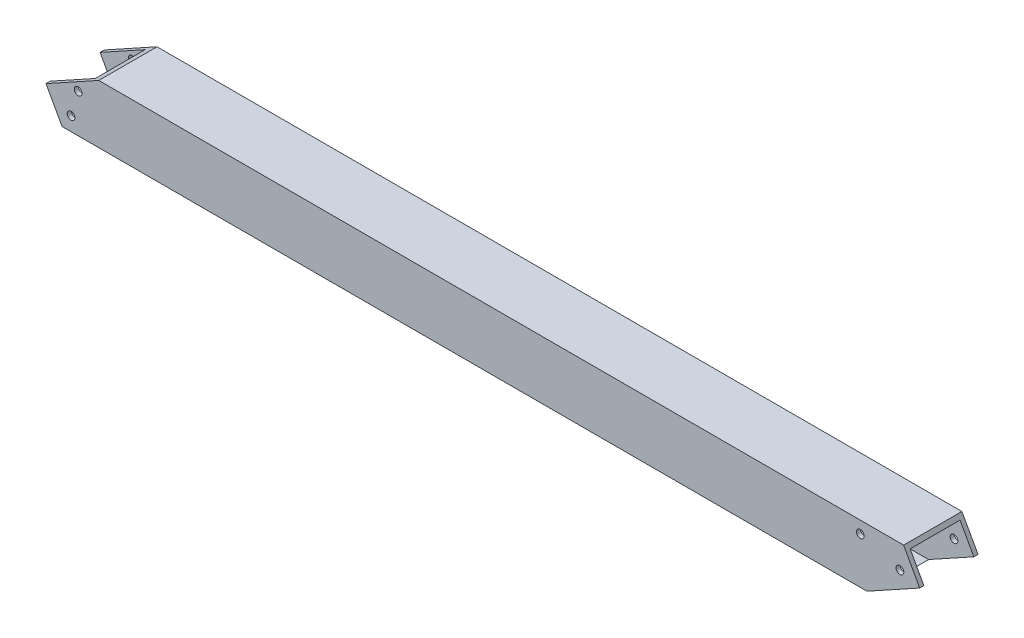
SolidWorks part; units mm, degrees
ref_plane "Front" through (0, 0, 0) normal (0, 0, 1) x (1, 0, 0)
ref_plane "Top" through (0, 0, 0) normal (0, 1, 0) x (1, 0, 0)
ref_plane "Right" through (0, 0, 0) normal (1, 0, 0) x (0, 0, -1)
sketch "Sketch1" plane through (0, 0, 0) normal (1, 0, 0) x (0, 0, -1)
  line L1 (0, 0) -> (50.8, 0)
  line L2 (0, 0) -> (0, 50.8)
  line L3 (0, 50.8) -> (50.8, 50.8)
  line L4 (50.8, 0) -> (50.8, 50.8)
  line L5 (3.6576, 47.1424) -> (47.1424, 47.1424)
  line L6 (3.6576, 47.1424) -> (3.6576, 3.6576)
  line L7 (3.6576, 3.6576) -> (47.1424, 3.6576)
  line L8 (47.1424, 47.1424) -> (47.1424, 3.6576)
  dimension "D1" = 50.8
  dimension "D2" = 50.8
  dimension "D3" = 3.6576
  dimension "D4" = 3.6576
  dimension "D5" = 3.6576
  dimension "D6" = 3.6576
extrude "Extrude1" add sketch "Sketch1" along normal blind 3048
sketch "Sketch4" plane through (0, 0, -50.8) normal (0, 0, -1) x (-1, 0, 0)
  line L1 (-3151.5296, 410.7202) -> (33.3961, 410.7202)
  line L2 (-3151.5296, 410.7202) -> (-3151.5296, -393.3626)
  line L3 (-3151.5296, -393.3626) -> (33.3961, -393.3626)
  line L4 (-3048, 25.4) -> (-1855.2021, 25.4) construction
  line L5 (-3048, 0) -> (-3048, 50.8) construction
  line L6 (-3048, 25.4) -> (-2464.3708, -296.9857)
  line L7 (-2464.3708, -296.9857) -> (-2286.2911, 25.4)
  line L8 (-3048, 25.4) -> (-2869.9203, 347.7857)
  line L9 (-2286.2911, 25.4) -> (-2869.9203, 347.7857)
  line L10 (33.3961, 410.7202) -> (33.3961, -393.3626)
  dimension "D3" = 666.75
  dimension "D4" = 368.3
extrude "Cut-Extrude1" cut sketch "Sketch4" against normal through all
sketch "Sketch5" plane through (0, 0, 0) normal (0, 0, 1) x (1, 0, 0)
  circle A0 centre (2996.2277, 40.3282) radius 3.3731
  circle A1 centre (3030.7426, 30.3761) radius 3.3731
  circle A2 centre (2308.1073, 12.0605) radius 3.3731
  circle A3 centre (2314.3273, 33.6323) radius 3.3731
  dimension "D1" = 6.7462
  dimension "D2" = 6.7462
extrude "Cut-Extrude2" cut sketch "Sketch5" against normal through all
